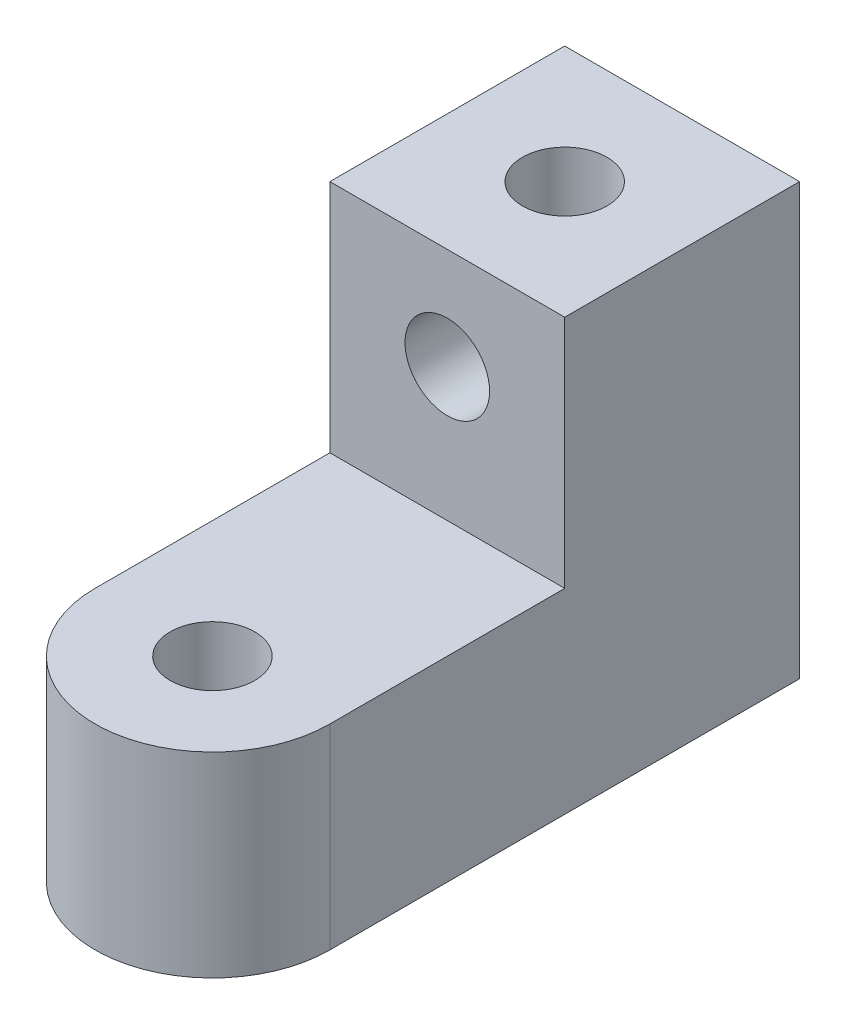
SolidWorks part; units mm, degrees
ref_plane "Front Plane" through (0, 0, 0) normal (0, 0, 1) x (1, 0, 0)
ref_plane "Top Plane" through (0, 0, 0) normal (0, 1, 0) x (1, 0, 0)
ref_plane "Right Plane" through (0, 0, 0) normal (1, 0, 0) x (0, 0, -1)
sketch "Sketch1" plane through (0, 0, 0) normal (0, 1, 0) x (1, 0, 0)
  line L0 (-15, 0) -> (15, 0)
  line L1 (15, 0) -> (15, -60)
  line L2 (-15, -60) -> (-15, 0)
  arc A0 (15, -60) -> (-15, -60) centre (0, -60) cw
  dimension "D2" = 15
  dimension "D1" = 60
extrude "Extrude1" add sketch "Sketch1" along normal blind 25
sketch "Sketch6" plane through (0, 25, 0) normal (0, 1, 0) x (-1, 0, 0)
  line L0 (-15, 60) -> (-15, 0) construction
  line L1 (15, 0) -> (-15, 0)
  line L2 (15, 0) -> (15, 30)
  line L3 (15, 30) -> (-15, 30)
  line L4 (-15, 0) -> (-15, 30)
  dimension "D1" = 30
extrude "Extrude2" add sketch "Sketch6" along normal blind 30
hole_wizard "M12x1.25 Tapped Hole4" positions "3DSketch6" profile "Sketch14" tap size "M12x1.25" standard "Ansi Metric"
sketch3d "3DSketch6"
  line L0 (0, 25, 60) -> (0, 0, 60) construction
  line L1 (-15, 25, 30) -> (15, 25, 30) construction
  line L2 (0, 55, 30) -> (0, 25, 30) construction
  line L3 (-15, 55, 30) -> (15, 55, 30) construction
  line L6 (0, 55, 30) -> (0, 55, 0) construction
  line L7 (15, 55, 0) -> (-15, 55, 0) construction
  point P0 (0, 25, 60)
  point P4 (0, 42, 30)
  point P6 (0, 55, 15)
  dimension "D1" = 17
sketch "Sketch14" plane through (0, 25, 60) normal (1, 0, 0) x (0, 0, 1)
  line L0 (0, 0) -> (0, 25)
  line L1 (0, 25) -> (5.4, 25)
  line L2 (5.4, 25) -> (5.4, 0)
  line L5 (5.4, 0) -> (0, 0)
  line L11 (0, -6.35) -> (0, 107.95) construction
  dimension "Thru Tap Drill Dia." = 10.8
  dimension "Thru Tap Drill Depth" = 25
